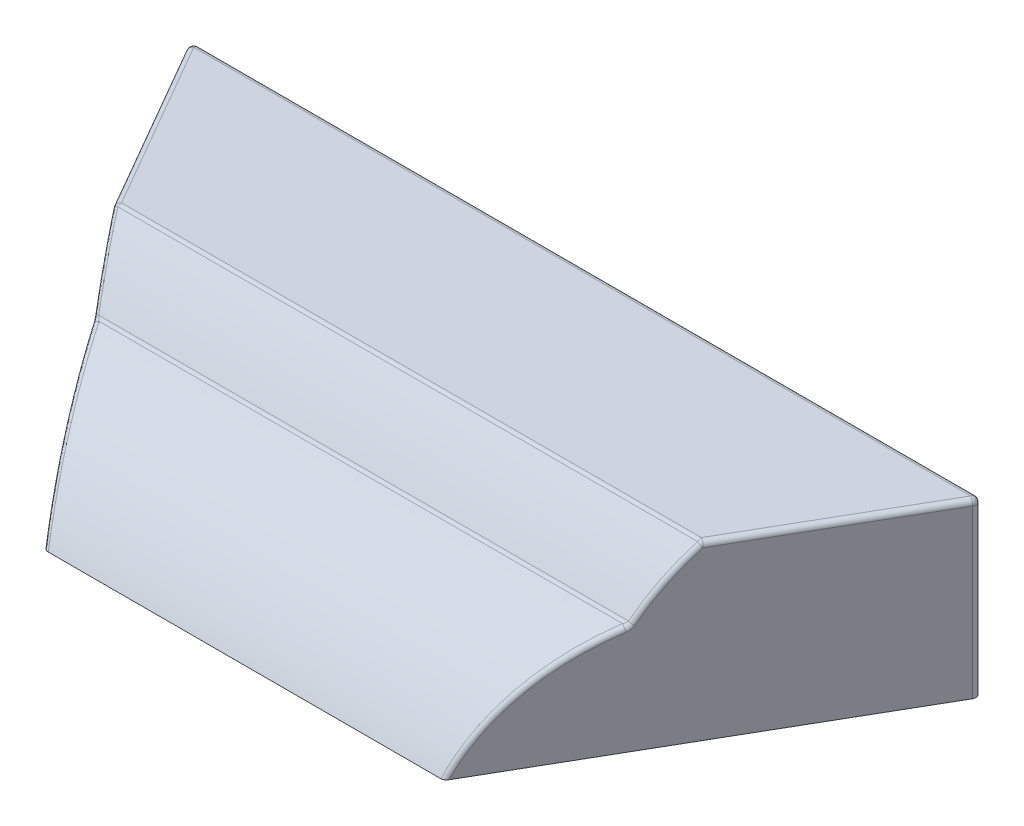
SolidWorks part; units mm, degrees
ref_plane "Front Plane" through (0, 0, 0) normal (0, 0, 1) x (1, 0, 0)
ref_plane "Top Plane" through (0, 0, 0) normal (0, 1, 0) x (1, 0, 0)
ref_plane "Right Plane" through (0, 0, 0) normal (1, 0, 0) x (0, 0, -1)
sketch "Sketch2" plane through (0, 0, 0) normal (1, 0, 0) x (0, 0, -1)
  line L2 (-86.3811, 248.8892) -> (0.5974, 248.8892)
  line L3 (0.5974, 248.8892) -> (0.5974, 164.8266)
  line L4 (0.5974, 164.8266) -> (-166.839, 164.8266)
  arc A0 (-166.839, 164.8266) -> (-109.1369, 218.3301) centre (-75.6662, 124.3661) cw
  arc A1 (-109.1369, 218.3301) -> (-86.3811, 248.8892) centre (6.9587, 155.6317) cw
  dimension "D1" = 99.7472
  dimension "D2" = 131.9443
  dimension "D3" = 0.5974
  dimension "D4" = 6.9587
  dimension "D5" = 75.6662
  dimension "D6" = 86.3811
  dimension "D7" = 109.1369
  dimension "D8" = 166.839
  dimension "D9" = 124.3661
extrude "Extrude1" add sketch "Sketch2" along normal up to surface and the other way up to surface
fillet "Fillet1" radius 2.54 11 edges at (-193.4703, 206.8579, -0.5974) (194.7257, 206.8579, -0.5974) (-110.2832, 197.5089, 143.487) (111.5385, 197.5089, 143.487) (0.6277, 218.3301, 109.1369) (-136.044, 234.4354, 98.8679) (137.2994, 234.4354, 98.8679) (0.6277, 248.8892, 86.3811) (-168.3618, 248.8892, 42.8918) (0.6277, 248.8892, -0.5974) (169.6172, 248.8892, 42.8918)
shell "Shell1" thickness 2.54
